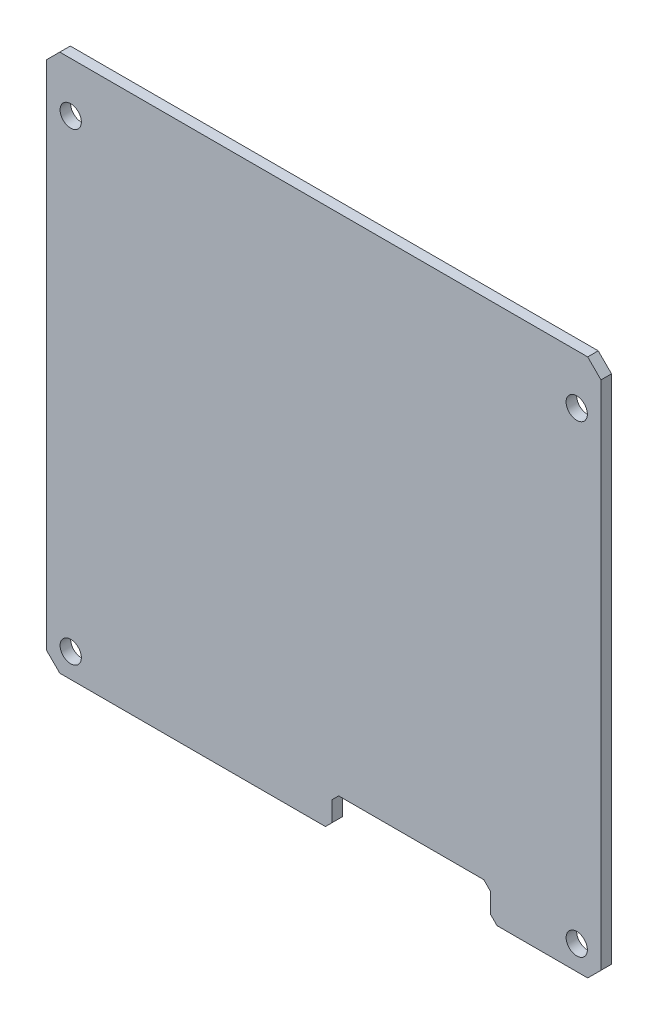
SolidWorks part; units mm, degrees
ref_plane "Front Plane" through (0, 0, 0) normal (0, 0, 1) x (1, 0, 0)
ref_plane "Top Plane" through (0, 0, 0) normal (0, 1, 0) x (1, 0, 0)
ref_plane "Right Plane" through (0, 0, 0) normal (1, 0, 0) x (0, 0, -1)
ref_plane "Plane1" through (0, 0, -1.6) normal (0, 0, -1) x (-1, 0, 0)
sketch "Sketch1" plane through (0, 0, -1.6) normal (0, 0, -1) x (-1, 0, 0)
  line L1 (-41.75, -40.5) -> (41.75, -40.5)
  line L2 (-41.75, -40.5) -> (-41.75, 40.5)
  line L3 (-41.75, 40.5) -> (41.75, 40.5)
  line L4 (41.75, -40.5) -> (41.75, 40.5)
  line L5 (-41.75, -40.5) -> (41.75, 40.5) construction
  line L6 (-41.75, 40.5) -> (41.75, -40.5) construction
  point P0 (0, 0)
  dimension "D1" = 83.5
  dimension "D2" = 81
extrude "Boss-Extrude1" add sketch "Sketch1" against normal blind 1.5875
sketch "Sketch8" plane through (0, 0, -1.6) normal (0, 0, -1) x (-1, 0, 0)
  line L0 (-41.75, -40.5) -> (41.75, -40.5) construction
  line L1 (-38.1, -36.85) -> (38.1, -36.85) construction
  line L2 (-38.1, -36.85) -> (-38.1, 33) construction
  line L3 (-38.1, 33) -> (38.1, 33) construction
  line L4 (38.1, -36.85) -> (38.1, 33) construction
  line L5 (-38.1, -36.85) -> (38.1, 33) construction
  line L6 (-38.1, 33) -> (38.1, -36.85) construction
  line L7 (38.1, -36.85) -> (41.75, -36.85) construction
  line L8 (41.75, -40.5) -> (41.75, 40.5) construction
  line L9 (38.1, -36.85) -> (38.1, -40.5) construction
  circle A0 centre (38.1, 33) radius 1.6
  circle A1 centre (-38.1, 33) radius 1.6
  circle A2 centre (-38.1, -36.85) radius 1.6
  circle A3 centre (38.1, -36.85) radius 1.6
  point P0 (0, -1.925)
  dimension "D1" = 3.2
  dimension "D2" = 76.2
  dimension "D3" = 69.85
fillet "Fillet1" [suppressed] radius 0.5
fillet "Fillet2" [suppressed] radius 0.5
fillet "Fillet3" [suppressed] radius 0.5
fillet "Fillet4" [suppressed] radius 0.5
extrude "Cut-Extrude6" cut sketch "Sketch8" against normal up to next
chamfer "Chamfer1" distance 2 angle 45 4 edges at (41.75, 40.5, -0.8063) (-41.75, 40.5, -0.8063) (-41.75, -40.5, -0.8063) (41.75, -40.5, -0.8063)
sketch "Sketch9" plane through (0, 0, -1.6) normal (0, 0, -1) x (-1, 0, 0)
  line L0 (-39.75, -40.5) -> (39.75, -40.5) construction
  line L1 (-1.25, -35.5) -> (-25.1, -35.5)
  line L2 (-1.25, -35.5) -> (-1.25, -40.5)
  line L3 (-1.25, -40.5) -> (-25.1, -40.5)
  line L4 (-25.1, -35.5) -> (-25.1, -40.5)
  line L5 (41.75, -38.5) -> (41.75, 38.5) construction
  circle A0 centre (-38.1, -36.85) radius 1.6 construction
  dimension "D2" = 13
  dimension "D1" = 5
  dimension "D3" = 43
extrude "Cut-Extrude7" cut sketch "Sketch9" against normal up to next
chamfer "Chamfer2" distance 1 angle 45 4 edges at (1.25, -40.5, -0.8063) (1.25, -35.5, -0.8063) (25.1, -35.5, -0.8063) (25.1, -40.5, -0.8063)
